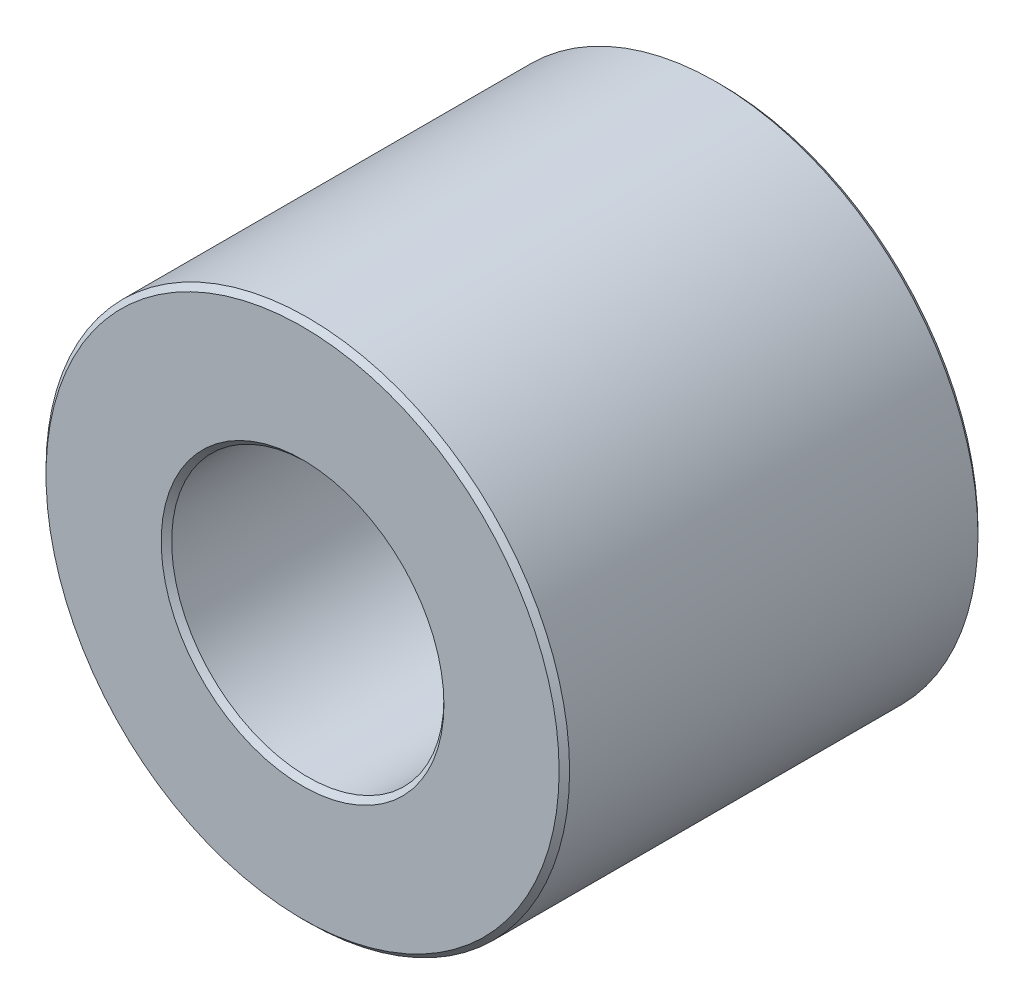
SolidWorks part; units mm, degrees
ref_plane "Front Plane" through (0, 0, 0) normal (0, 0, 1) x (1, 0, 0)
ref_plane "Top Plane" through (0, 0, 0) normal (0, 1, 0) x (1, 0, 0)
ref_plane "Right Plane" through (0, 0, 0) normal (1, 0, 0) x (0, 0, -1)
sketch "Sketch1" plane through (0, 0, 0) normal (0, 0, 1) x (1, 0, 0)
  circle A0 centre (0, 0) radius 5
  circle A1 centre (0, 0) radius 2.6
  dimension "D1" = 10
  dimension "D2" = 5.2
extrude "Boss-Extrude2" add sketch "Sketch1" along normal mid plane 8
chamfer "Chamfer3" distance 0.1 angle 45 4 edges at (5, 0, 4) (5, 0, -4) (2.6, 0, -4) (2.6, 0, 4)
